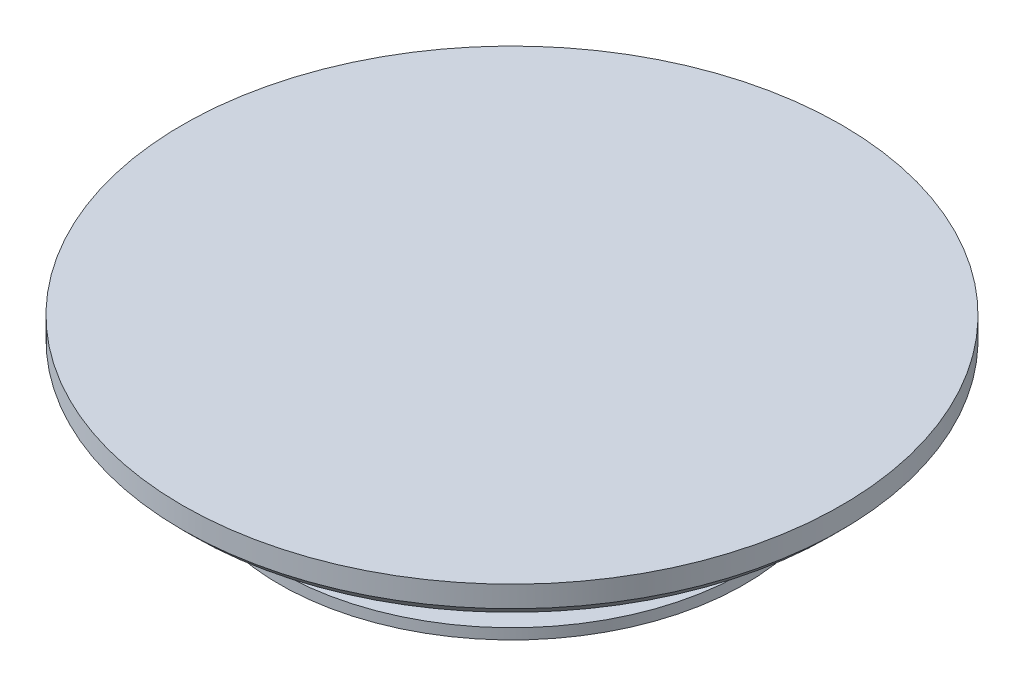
SolidWorks part; units mm, degrees
ref_plane "Front Plane" through (0, 0, 0) normal (0, 0, 1) x (1, 0, 0)
ref_plane "Top Plane" through (0, 0, 0) normal (0, 1, 0) x (1, 0, 0)
ref_plane "Right Plane" through (0, 0, 0) normal (1, 0, 0) x (0, 0, -1)
sketch "Sketch1" plane through (0, 0, 0) normal (0, 0, 1) x (1, 0, 0)
  line L0 (15.5, 5.5) -> (15.5, 4.5)
  line L1 (0, 0) -> (15.5, 0)
  line L2 (0, 0) -> (0, 5.5)
  line L3 (0, 5.5) -> (15.5, 5.5)
  line L4 (15.5, 0) -> (15.5, 5.5)
  line L5 (15.5, 4.5) -> (15, 4)
  line L6 (15, 4) -> (12, 4)
  line L7 (12, 4) -> (9.9369, 0.5)
  line L8 (9.9369, 0.5) -> (10.9369, 0.5)
  line L9 (10.9369, 0.5) -> (10.9369, 0)
  dimension "D1" = 5.5
  dimension "D2" = 15.5
  dimension "D3" = 1
  dimension "D4" = 0.5
  dimension "D5" = 0.5
  dimension "D6" = 3
  dimension "D7" = 0.5
  dimension "D8" = 1
revolve "Revolve1" add sketch "Sketch1" angle 360 about L2
